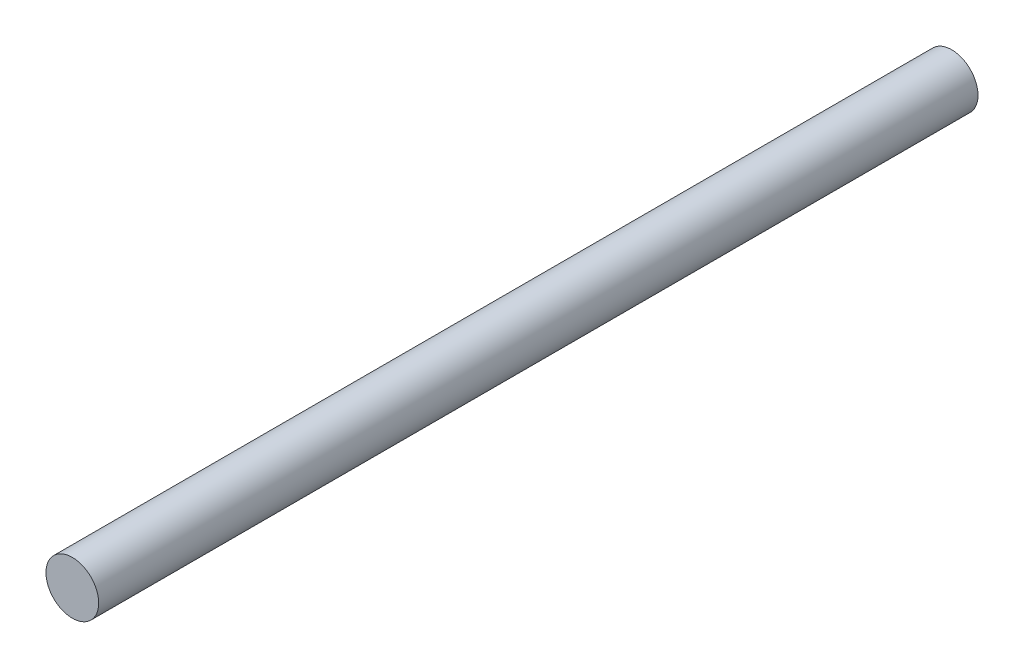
SolidWorks part; units mm, degrees
ref_plane "Face" through (0, 0, 0) normal (0, 0, 1) x (1, 0, 0)
ref_plane "Dessus" through (0, 0, 0) normal (0, 1, 0) x (1, 0, 0)
ref_plane "Droite" through (0, 0, 0) normal (1, 0, 0) x (0, 0, -1)
sketch "Esquisse1" plane through (0, 0, 0) normal (0, 0, 1) x (1, 0, 0)
  circle A0 centre (0, 0) radius 1.5
  dimension "D1" = 3
extrude "Extrusion1" add sketch "Esquisse1" along normal blind 50
